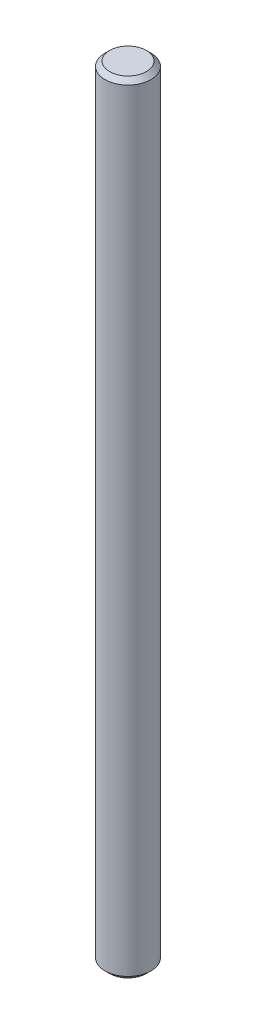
SolidWorks part; units mm, degrees
ref_plane "Front" through (0, 0, 0) normal (0, 0, 1) x (1, 0, 0)
ref_plane "Top" through (0, 0, 0) normal (0, 1, 0) x (1, 0, 0)
ref_plane "Right" through (0, 0, 0) normal (1, 0, 0) x (0, 0, -1)
sketch "Sketch1" plane through (0, 0, 0) normal (0, 1, 0) x (1, 0, 0)
  circle A0 centre (0, 0) radius 2
  dimension "D1" = 4
extrude "Extrude1" add sketch "Sketch1" along normal blind 68
chamfer "Chamfer1" distance 0.4 angle 45 2 edges at (0, 0, 2) (0, 68, 2)
